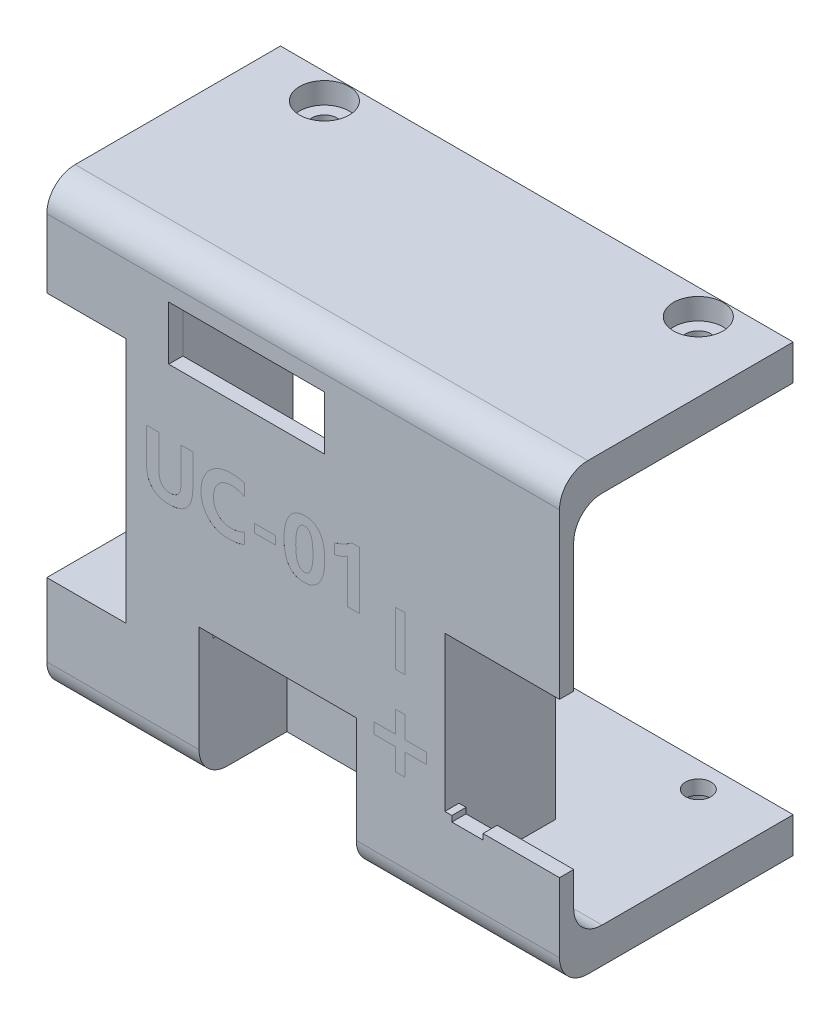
SolidWorks part; units mm, degrees
ref_plane "前视基准面" through (0, 0, 0) normal (0, 0, 1) x (1, 0, 0)
ref_plane "上视基准面" through (0, 0, 0) normal (0, 1, 0) x (1, 0, 0)
ref_plane "右视基准面" through (0, 0, 0) normal (1, 0, 0) x (0, 0, -1)
sketch "草图1" plane through (0, 0, 0) normal (0, 0, 1) x (1, 0, 0)
  line L0 (-17.8, 8.85) -> (-12.8, 8.85)
  line L2 (-12.8, 8.85) -> (-12.8, 0.35)
  line L3 (-12.8, 0.35) -> (-5.9, 0.35)
  line L4 (-5.9, 0.35) -> (-5.9, -6.45)
  line L5 (-5.9, -6.45) -> (-12.8, -6.45)
  line L6 (-12.8, -6.45) -> (-12.8, -8.55)
  line L7 (-12.8, -8.55) -> (-17.8, -8.55)
  line L8 (-17.8, -8.55) -> (-17.8, -14.2)
  line L9 (-17.8, -14.2) -> (17.8, -14.2)
  line L10 (17.8, -14.2) -> (17.8, -8.8)
  line L11 (17.8, -8.8) -> (12.4, -8.8)
  line L12 (9.7, -8.8) -> (9.7, 2.1)
  line L13 (9.7, 2.1) -> (17.8, 2.1)
  line L14 (17.8, 2.1) -> (17.8, 14.2013)
  line L15 (17.8, 14.2013) -> (-17.8, 14.2)
  line L16 (-17.8, 14.2) -> (-17.8, 8.85)
  line L31 (-9.7903, 12.6005) -> (1.2097, 12.6005)
  line L32 (-9.7903, 12.6005) -> (-9.7903, 8.8005)
  line L33 (-9.7903, 8.8005) -> (1.2097, 8.8005)
  line L34 (1.2097, 12.6005) -> (1.2097, 8.8005)
  line L35 (-6.35, -7.9) -> (2.25, -7.9) construction
  line L36 (-6.35, -7.9) -> (-6.35, -11.4) construction
  line L37 (-6.35, -11.4) -> (2.25, -11.4) construction
  line L38 (2.25, -7.9) -> (2.25, -11.4) construction
  line L42 (10.2, -8.8) -> (10.2, -9.2)
  line L43 (10.2, -9.2) -> (12.4, -9.2)
  line L44 (12.4, -9.2) -> (12.4, -8.8)
  line L45 (10.2, -8.8) -> (9.7, -8.8)
  point P0 (1.2097, 10.7005)
  dimension "D1" = 11
  dimension "D3" = 3.8
  dimension "D4" = 3.5
  dimension "D5" = 2.8
  dimension "D20" = 0.4
  dimension "D21" = 5.4
  dimension "D22" = 0.5
extrude "凸台-拉伸1" add sketch "草图1" against normal blind 1
sketch "草图2" plane through (0, 0, -1) normal (0, 0, -1) x (-1, 0, 0)
  line L0 (-17.8, -14.2) -> (-17.8, -8.8) construction
  line L1 (17.8, -14.2) -> (-17.8, -14.2)
  line L2 (17.8, -14.2) -> (17.8, -13.2)
  line L3 (17.8, -13.2) -> (-17.8, -13.2)
  line L4 (-17.8, -14.2) -> (-17.8, -13.2)
  line L6 (17.8, 13.2013) -> (-17.8, 13.2013)
  line L7 (17.8, 13.2013) -> (17.8, 14.2013)
  line L8 (17.8, 14.2013) -> (-17.8, 14.2013)
  line L9 (-17.8, 13.2013) -> (-17.8, 14.2013)
  line L12 (17.8, 14.2) -> (17.8, 8.85) construction
  dimension "D1" = 1
  dimension "D2" = 1
extrude "凸台-拉伸2" add sketch "草图2" along normal blind 15.5
fillet "圆角1" radius 2 2 edges at (0, -13.2, -1) (0, 13.2013, -1)
sketch "草图3" plane through (0, 14.2013, 0) normal (0, 1, 0) x (1, 0, 0)
  line L0 (-17.8, 16.5) -> (17.8, 16.5) construction
  line L3 (-13.5, 14.7) -> (12.9, 14.7) construction
  line L4 (-0.3, 14.7) -> (-0.3, 0) construction
  circle A1 centre (-13.5, 14.7) radius 0.9
  circle A3 centre (12.9, 14.7) radius 0.9
  dimension "D1" = 1.8
  dimension "D2" = 1.8
  dimension "D3" = 26.4
  dimension "D4" = 1.8
  dimension "D5" = 0.3
extrude "切除-拉伸1" cut sketch "草图3" against normal through all
sketch "草图4" plane through (17.8, 0, 0) normal (1, 0, 0) x (0, 0, -1)
  line L0 (2, 14.2013) -> (16.5, 14.2013)
  line L1 (0, 2.1) -> (0, -8.8)
  line L2 (1, 2.1) -> (1, -8.8)
  line L6 (0, -8.8) -> (0, -14.2)
  line L7 (0, -14.2) -> (16.5, -14.2)
  line L8 (16.5, -14.2) -> (16.5, -13.2)
  line L9 (16.5, -13.2) -> (3, -13.2)
  line L10 (1, -11.2) -> (1, -8.8)
  line L11 (1, -8.8) -> (0, -8.8)
  line L12 (0, -8.8) -> (0, -12.2)
  line L13 (2, -14.2) -> (16.5, -14.2)
  line L14 (16.5, -14.2) -> (16.5, -13.2)
  line L15 (16.5, -13.2) -> (3, -13.2)
  line L16 (1, -11.2) -> (1, -8.8)
  line L19 (0, 14.2013) -> (0, 2.1)
  line L20 (0, 2.1) -> (1, 2.1)
  line L21 (1, 2.1) -> (1, 11.2013)
  line L22 (3, 13.2013) -> (16.5, 13.2013)
  line L23 (16.5, 13.2013) -> (16.5, 14.2013)
  line L24 (16.5, 14.2013) -> (1, 14.2013)
  line L26 (0, 12.2013) -> (0, 2.1)
  line L28 (1, 2.1) -> (1, 11.2013)
  line L29 (3, 13.2013) -> (16.5, 13.2013)
  line L30 (16.5, 13.2013) -> (16.5, 14.2013)
  line L36 (1, 14.2013) -> (0, 14.2013)
  arc A0 (0, -12.2) -> (2, -14.2) centre (2, -12.2) ccw
  arc A1 (1, -11.2) -> (3, -13.2) centre (3, -11.2) ccw
  arc A2 (1, -11.2) -> (3, -13.2) centre (3, -11.2) ccw
  arc A3 (3, 13.2013) -> (1, 11.2013) centre (3, 11.2013) ccw
  arc A4 (3, 13.2013) -> (1, 11.2013) centre (3, 11.2013) ccw
  arc A5 (0, 12.2013) -> (2, 14.2013) centre (2, 12.2013) cw
  dimension "D3" = 2
  dimension "D1" = 0
  dimension "D2" = 0
extrude "切除-拉伸2" cut sketch "草图4" against normal through all flip side to cut
other "删除面1"
sketch "草图6" plane through (-17.8, 0, 0) normal (-1, 0, 0) x (0, 0, 1)
  line L0 (-16.5, 13.2013) -> (-3, 13.2013) construction
  line L1 (-16.5, -13.2) -> (-3, -13.2) construction
  line L2 (-1, -8.55) -> (-1, -11.2) construction
  line L3 (-1, 11.2013) -> (-1, 8.85) construction
  line L4 (-10.2, 13.2013) -> (-3, 13.2013)
  line L5 (-10.2, -13.2) -> (-3, -13.2)
  line L6 (-1, -8.55) -> (-1, -11.2)
  line L7 (-1, 11.2013) -> (-1, 8.85)
  line L8 (-1, 8.85) -> (-10.2, 8.85)
  line L9 (-10.2, 12.0027) -> (-10.2, -11.9987) construction
  line L10 (-10.2, 8.85) -> (-10.2, 13.2013)
  line L11 (-1, -8.55) -> (-10.2, -8.55)
  line L12 (-10.2, -8.55) -> (-10.2, -13.2)
  arc A0 (-3, -13.2) -> (-1, -11.2) centre (-3, -11.2) ccw construction
  arc A1 (-1, 11.2013) -> (-3, 13.2013) centre (-3, 11.2013) ccw construction
  arc A2 (-3, -13.2) -> (-1, -11.2) centre (-3, -11.2) ccw
  arc A3 (-1, 11.2013) -> (-3, 13.2013) centre (-3, 11.2013) ccw
extrude "凸台-拉伸3" add sketch "草图6" against normal blind 8
sketch "草图7" plane through (0, 0, -1) normal (0, 0, -1) x (-1, 0, 0)
  line L0 (9.8, 8.85) -> (12.8, 8.85) construction
  line L1 (12.8, 8.85) -> (9.8, 8.85)
  line L2 (12.8, 8.85) -> (12.8, 0.85)
  line L3 (12.8, 0.85) -> (9.8, 0.85)
  line L4 (9.8, 8.85) -> (9.8, 0.85)
  line L5 (12.8, -8.55) -> (9.8, -8.55)
  line L6 (12.8, -8.55) -> (12.8, -6.55)
  line L7 (12.8, -6.55) -> (9.8, -6.55)
  line L8 (9.8, -8.55) -> (9.8, -6.55)
  line L9 (9.8, -11.2) -> (9.8, -8.55) construction
  dimension "D1" = 8
  dimension "D2" = 2
extrude "凸台-拉伸4" add sketch "草图7" along normal blind 7.8
sketch "草图9" plane through (9.7, 0, 0) normal (1, 0, 0) x (0, 0, -1)
  line L1 (1, 11.2013) -> (1, -11.2)
  line L2 (3, -13.2) -> (8.8, -13.2)
  line L4 (8.8, -13.2) -> (8.8, 13.2013)
  line L5 (16.5, 13.2013) -> (3, 13.2013) construction
  line L6 (8.8, 13.2013) -> (3, 13.2013)
  line L7 (16.5, -13.2) -> (3, -13.2) construction
  arc A0 (3, 13.2013) -> (1, 11.2013) centre (3, 11.2013) ccw construction
  arc A1 (1, -11.2) -> (3, -13.2) centre (3, -11.2) ccw construction
  arc A2 (3, 13.2013) -> (1, 11.2013) centre (3, 11.2013) ccw
  arc A3 (1, -11.2) -> (3, -13.2) centre (3, -11.2) ccw
  dimension "D1" = 7.8
extrude "凸台-拉伸6" add sketch "草图9" against normal blind 6 contours L4 L6 A2 L1 A3 L2
other "移动面1" [suppressed] parameters "D1"=5
sketch "草图10" plane through (0, 0, 0) normal (0, 0, 1) x (1, 0, 0)
  line L0 (-12.8, 8.85) -> (-12.8, 10.85)
  line L2 (-12.8, 10.85) -> (-15.3, 10.85)
  line L3 (-15.3, 10.85) -> (-15.3, 8.85)
  line L4 (-17.8, 8.85) -> (-12.8, 8.85) construction
  dimension "D1" = 2.5
  dimension "D2" = 2
extrude "切除-拉伸3" cut sketch "草图10" against normal through all and the other way through all
sketch "草图11" plane through (0, 0, 0) normal (0, 0, 1) x (1, 0, 0)
  line L0 (-15.3, -8.55) -> (-15.3, -10.55)
  line L2 (-15.3, -10.55) -> (-12.8, -10.55)
  line L3 (-12.8, -10.55) -> (-12.8, -8.55)
  line L5 (-12.8, -8.55) -> (-17.8, -8.55) construction
  dimension "D1" = 2.5
  dimension "D2" = 2
extrude "切除-拉伸4" cut sketch "草图11" against normal through all and the other way through all
other "移动面2" parameters "D1"=0.6
other "移动面3" parameters "D1"=4.65
other "移动面5" parameters "D1"=4.35
sketch "草图13" plane through (0, 0, -8.8) normal (0, 0, -1) x (-1, 0, 0)
  line L0 (-3.7, -13.2) -> (-3.7, 13.2013) construction
  line L1 (-9.7, 13.2013) -> (-3.7, 13.2013)
  line L2 (-9.7, 13.2013) -> (-9.7, 0.0007)
  line L3 (-9.7, 0.0007) -> (-3.7, 0.0007)
  line L4 (-3.7, 13.2013) -> (-3.7, 0.0007)
extrude "切除-拉伸5" cut sketch "草图13" against normal blind 1
sketch "草图14" plane through (0, 0, 0) normal (0, 0, 1) x (1, 0, 0)
  line L0 (-12.8, 10.85) -> (-12.8, -10.55) construction
  line L1 (-15.3, 10.85) -> (-12.8, 10.85)
  line L2 (-15.3, 10.85) -> (-15.3, 8.85)
  line L3 (-15.3, 8.85) -> (-12.8, 8.85)
  line L4 (-12.8, 10.85) -> (-12.8, 8.85)
  line L6 (-15.3, -8.55) -> (-12.8, -8.55)
  line L7 (-15.3, -8.55) -> (-15.3, -10.55)
  line L8 (-15.3, -10.55) -> (-12.8, -10.55)
  line L9 (-12.8, -8.55) -> (-12.8, -10.55)
extrude "凸台-拉伸7" add sketch "草图14" against normal up to surface (8.8 mm away)
sketch "草图16" plane through (0, 0, 0) normal (0, 0, 1) x (1, 0, 0)
  line L0 (17.7, -11.9987) -> (-18.3, -11.9987) construction
  line L1 (-7.6499, -8.1987) -> (3.3501, -8.1987)
  line L2 (-7.6499, -8.1987) -> (-7.6499, -11.9987)
  line L3 (-7.6499, -11.9987) -> (3.3501, -11.9987)
  line L4 (3.3501, -8.1987) -> (3.3501, -11.9987)
  line L5 (-7.6499, -8.1987) -> (3.3501, -11.9987) construction
  line L6 (-7.6499, -11.9987) -> (3.3501, -8.1987) construction
  line L7 (-2.1499, -9.7947) -> (-2.1499, -10.3027) construction
  point P4 (-2.1499, -10.0987)
  dimension "D1" = 11
  dimension "D2" = 3.8
extrude "切除-拉伸7" cut sketch "草图16" against normal blind 10
sketch "草图17" plane through (0, -14.2, 0) normal (0, -1, 0) x (1, 0, 0)
  line L1 (-7.6499, 0) -> (3.3501, 0)
  line L2 (-7.6499, 0) -> (-7.6499, -6.2)
  line L3 (-7.6499, -6.2) -> (3.3501, -6.2)
  line L4 (3.3501, 0) -> (3.3501, -6.2)
  line L5 (-7.6499, 0) -> (3.3501, -6.2) construction
  line L6 (-7.6499, -6.2) -> (3.3501, 0) construction
  line L7 (3.3501, -1.1664) -> (3.3501, 0) construction
  line L8 (-18.4, 0) -> (17.8, 0) construction
  point P4 (-2.1499, -3.1)
  dimension "D1" = 6.2
extrude "切除-拉伸8" cut sketch "草图17" against normal up to surface (6.0013 mm away)
sketch "草图18" plane through (0, 0, -1) normal (0, 0, -1) x (-1, 0, 0)
  line L0 (-3.7, 11.2013) -> (-3.7, -11.2) construction
  line L1 (-3.7, -8.1987) -> (5.5675, -8.1987)
  line L2 (-3.7, -8.1987) -> (-3.7, -5.1987)
  line L3 (-3.7, -5.1987) -> (5.5675, -5.1987)
  line L4 (5.5675, -7.3751) -> (5.5675, -5.1987)
  line L5 (-3.7, -8.1987) -> (5.5675, -5.1987) construction
  line L6 (-3.7, -5.1987) -> (5.5675, -8.1987) construction
  line L8 (-3.3501, -8.1987) -> (7.6499, -8.1987) construction
  line L9 (5.5675, -7.3751) -> (9.8, -7.3751)
  line L10 (9.8, -7.3751) -> (9.8, -13.2)
  line L12 (9.8, -13.2) -> (7.6499, -13.2)
  line L13 (7.6499, -13.2) -> (7.6499, -8.1987)
  line L16 (7.6499, -8.1987) -> (5.5675, -8.1987)
  line L17 (9.8, -6.55) -> (9.8, -13.2) construction
  line L19 (9.8, -13.2) -> (7.6499, -13.2) construction
  point P4 (0.9337, -6.6987)
  dimension "D1" = 3
extrude "凸台-拉伸8" add sketch "草图18" along normal up to surface (7.8 mm away)
other "移动面6" parameters "D1"=0.25
sketch "草图20" plane through (0, -14.2, 0) normal (0, -1, 0) x (1, 0, 0)
  line L1 (-7.6499, -6.2) -> (3.7, -6.2)
  line L2 (-7.6499, -6.2) -> (-7.6499, -8.8)
  line L3 (-7.6499, -8.8) -> (3.7, -8.8)
  line L4 (3.7, -6.2) -> (3.7, -8.8)
  line L5 (-7.6499, -6.2) -> (3.7, -8.8) construction
  line L6 (-7.6499, -8.8) -> (3.7, -6.2) construction
  point P4 (-1.9749, -7.5)
extrude "凸台-拉伸9" add sketch "草图20" against normal blind 2.5
other "删除面2"
other "移动面8" parameters "D1"=1.5
sketch "草图21" plane through (0, -15.7, 0) normal (0, -1, 0) x (1, 0, 0)
  circle A0 centre (-13.5, -14.7) radius 1.75
  circle A1 centre (12.9, -14.7) radius 1.75
  dimension "D1" = 3.5
extrude "切除-拉伸9" cut sketch "草图21" against normal blind 1.5
sketch "草图22" plane through (0, 15.7013, 0) normal (0, 1, 0) x (1, 0, 0)
  circle A0 centre (-13.5, 14.7) radius 1.75
  circle A1 centre (12.9, 14.7) radius 1.75
  dimension "D1" = 3.5
extrude "切除-拉伸10" cut sketch "草图22" against normal blind 1.5
fillet "圆角2" radius 2 3 edges at (-13.0249, -15.7, 0) (10.5751, -15.7, 0) (-0.3, 15.7013, 0)
sketch "草图23" plane through (0, 0, 0) normal (0, 0, 1) x (1, 0, 0)
  line L0 (-12.8, 8.85) -> (-12.8, -8.55) construction
  text T0 "UC-01" font "微软雅黑" height 4
  dimension "D1" = 1
extrude "切除-拉伸11" cut sketch "草图23" against normal blind 0.2
sketch "草图24" plane through (0, 0, -0.2) normal (0, 0, 1) x (1, 0, 0)
  line L5 (-2.239, 1.5082) -> (-2.239, 2.0935) construction
  line L6 (-2.239, 2.0935) -> (-3.7512, 2.0935) construction
  line L7 (-3.7512, 2.0935) -> (-3.7512, 1.5082) construction
  line L8 (-3.7512, 1.5082) -> (-2.239, 1.5082) construction
  line L9 (-4.4341, 0.4495) -> (-4.4341, 1.2155) construction
  line L10 (-4.4341, 3.3618) -> (-4.4341, 4.185) construction
  line L11 (-8.0927, 2.0203) -> (-8.0927, 4.2886) construction
  line L12 (-8.0927, 4.2886) -> (-8.922, 4.2886) construction
  line L13 (-8.922, 4.2886) -> (-8.922, 1.9304) construction
  line L14 (-10.4829, 1.967) -> (-10.4829, 4.2886) construction
  line L15 (-10.4829, 4.2886) -> (-11.361, 4.2886) construction
  line L16 (-11.361, 4.2886) -> (-11.361, 1.9739) construction
  line L22 (-2.239, 1.5082) -> (-2.239, 2.0935)
  line L23 (-2.239, 2.0935) -> (-3.7512, 2.0935)
  line L24 (-3.7512, 2.0935) -> (-3.7512, 1.5082)
  line L25 (-3.7512, 1.5082) -> (-2.239, 1.5082)
  line L26 (-4.4341, 0.4495) -> (-4.4341, 1.2155)
  line L27 (-4.4341, 3.3618) -> (-4.4341, 4.185)
  line L28 (-8.0927, 2.0203) -> (-8.0927, 4.2886)
  line L29 (-8.0927, 4.2886) -> (-8.922, 4.2886)
  line L30 (-8.922, 4.2886) -> (-8.922, 1.9304)
  line L31 (-10.4829, 1.967) -> (-10.4829, 4.2886)
  line L32 (-10.4829, 4.2886) -> (-11.361, 4.2886)
  line L33 (-11.361, 4.2886) -> (-11.361, 1.9739)
  line L39 (3.6634, 4.3374) -> (3.1405, 4.3374)
  line L40 (1.9073, 3.733) -> (1.9073, 3.0203)
  line L41 (2.8341, 3.3931) -> (2.8341, 0.2886)
  line L42 (2.8341, 0.2886) -> (3.6634, 0.2886)
  line L43 (3.6634, 0.2886) -> (3.6634, 4.3374)
  line L44 (3.6634, 4.3374) -> (3.1405, 4.3374)
  line L45 (1.9073, 3.733) -> (1.9073, 3.0203)
  line L46 (2.8341, 3.3931) -> (2.8341, 0.2886)
  line L47 (2.8341, 0.2886) -> (3.6634, 0.2886)
  line L48 (3.6634, 0.2886) -> (3.6634, 4.3374)
  spline S3 degree 3 poles (447.3482, -890.9115) (-3.7031, 15.2341) (-1.3723, 2.5269) (-4.6578, 1.1076) (-4.7746, 1.0655) (-4.8945, 1.0311) (-5.0173, 1.0045) (-5.143, 0.9854) (-8.9746, 0.6371) (-13.3163, 12.608) (28.2486, -998.4467) knots -10.258138 -10.258138 -10.258138 -10.258138 0.123289 0.246059 0.368848 0.492193 0.616624 0.741912 0.870046 12.042592 12.042592 12.042592 12.042592 only from (-4.4341, 1.2155) to (-5.4021, 0.9716) construction
  spline S4 degree 3 poles (-58.3829, -997.62) (2.0899, 14.5382) (-2.224, 0.5394) (-5.6685, 0.9915) (-5.7921, 1.0193) (-5.9084, 1.0588) (-6.0178, 1.1077) (-6.1193, 1.1696) (-6.2134, 1.2425) (-6.3001, 1.3254) (-6.3779, 1.4176) (-6.4452, 1.5179) (-6.502, 1.6255) (-6.5482, 1.74) (-6.5853, 1.8613) (-6.6108, 1.9897) (-7.0383, 5.7463) (6.2612, 10.2353) (-1005.5774, -43.2789) knots -4.971116 -4.971116 -4.971116 -4.971116 0.068212 0.133499 0.196423 0.256776 0.316257 0.374705 0.433557 0.493283 0.55321 0.612969 0.672933 0.734251 0.796781 0.861688 0.929139 6.423769 6.423769 6.423769 6.423769 only from (-5.4021, 0.9716) to (-6.6293, 2.2658) construction
  spline S5 degree 3 poles (-1005.0194, 58.9049) (7.2315, -5.5986) (-7.0712, -1.0508) (-6.6088, 2.5493) (-6.5834, 2.6819) (-6.5435, 2.8065) (-6.4952, 2.925) (-6.4344, 3.0358) (-6.3634, 3.14) (-6.2818, 3.2359) (-6.1914, 3.3228) (-6.0925, 3.3987) (-5.9863, 3.4631) (-5.8724, 3.5148) (-5.7519, 3.5567) (-5.6235, 3.5852) (-1.9471, 4.0411) (2.5575, -9.464) (-57.0147, 1002.2588) knots -5.005182 -5.005182 -5.005182 -5.005182 0.070115 0.137017 0.20143 0.263758 0.324619 0.384879 0.445005 0.50533 0.565469 0.624812 0.684081 0.74352 0.80411 0.866968 0.932059 6.116477 6.116477 6.116477 6.116477 only from (-6.6293, 2.2658) to (-5.348, 3.6057) construction
  spline S6 degree 3 poles (31.8274, 1002.913) (-12.9494, -8.1188) (-8.7481, 3.9419) (-5.1001, 3.5918) (-4.9804, 3.5729) (-4.8642, 3.5463) (-4.7515, 3.5116) (-4.6419, 3.4698) (-1.6184, 2.0699) (-4.6337, -10.5677) (474.6811, 881.1006) knots -11.08115 -11.08115 -11.08115 -11.08115 0.131365 0.260042 0.386555 0.51068 0.633019 0.755687 0.877798 11.054687 11.054687 11.054687 11.054687 only from (-5.348, 3.6057) to (-4.4341, 3.3618) construction
  spline S7 degree 3 poles (327.0674, 947.639) (-1.7117, -8.2725) (-1.351, 3.2979) (-4.6427, 4.2535) (-4.7555, 4.2791) (-4.8743, 4.3006) (-4.9989, 4.317) (-5.1293, 4.3294) (-10.0457, 4.5726) (-15.1405, -5.5057) (1.7412, 1004.308) knots -10.047872 -10.047872 -10.047872 -10.047872 0.107963 0.220366 0.337373 0.458737 0.586233 0.718567 0.855895 15.509195 15.509195 15.509195 15.509195 only from (-4.4341, 4.185) to (-5.4059, 4.3374) construction
  spline S8 degree 3 poles (-57.6899, 1002.9688) (4.8826, -11.7097) (-1.0209, 4.9509) (-5.8467, 4.3035) (-6.0532, 4.2577) (-6.2486, 4.1914) (-6.4341, 4.1079) (-6.608, 4.0037) (-6.7721, 3.8824) (-6.9228, 3.7421) (-7.0597, 3.5879) (-7.1799, 3.4223) (-7.2815, 3.2455) (-7.3636, 3.0577) (-7.4291, 2.8596) (-7.4742, 2.6503) (-8.1108, -2.3067) (8.3132, -8.2822) (-1006.272, 51.6656) knots -4.141639 -4.141639 -4.141639 -4.141639 0.067389 0.13232 0.194855 0.255866 0.316133 0.376011 0.436454 0.4979 0.55941 0.620133 0.680255 0.740957 0.802757 0.866128 0.931705 5.254621 5.254621 5.254621 5.254621 only from (-5.4059, 4.3374) to (-7.5073, 2.204) construction
  spline S9 degree 3 poles (-1006.6116, -40.0715) (7.5102, 12.5009) (-8.0628, 6.7177) (-7.478, 1.7826) (-7.4368, 1.5864) (-7.3799, 1.4011) (-7.3058, 1.227) (-7.2143, 1.0645) (-7.1073, 0.9129) (-6.9845, 0.7733) (-6.8475, 0.6478) (-6.6982, 0.5376) (-6.5361, 0.4464) (-6.3636, 0.3701) (-6.1792, 0.3118) (-5.9834, 0.2699) (-1.1365, -0.3279) (4.6206, 15.6065) (-50.5508, -998.7248) knots -4.566138 -4.566138 -4.566138 -4.566138 0.069616 0.136223 0.200084 0.261924 0.322179 0.381519 0.440709 0.500203 0.559804 0.618828 0.678076 0.738077 0.799831 0.863504 0.93014 5.483125 5.483125 5.483125 5.483125 only from (-7.5073, 2.204) to (-5.5614, 0.2399) construction
  spline S10 degree 3 poles (8.5748, -999.6594) (-15.6172, 11.7428) (-10.2761, -0.0632) (-5.2329, 0.2514) (-5.0795, 0.2681) (-4.9342, 0.2908) (-4.7968, 0.3193) (-4.6682, 0.3563) (-1.3965, 1.4907) (-3.0171, 14.5127) (382.1615, -921.7816) knots -12.687678 -12.687678 -12.687678 -12.687678 0.147062 0.286452 0.419776 0.547259 0.667915 0.783756 0.894285 9.644628 9.644628 9.644628 9.644628 only from (-5.5614, 0.2399) to (-4.4341, 0.4495) construction
  spline S11 degree 3 poles (990.6881, -25.9645) (-19.9383, 9.2654) (-8.6331, 5.2812) (-8.9327, 1.7077) (-8.948, 1.6064) (-8.9681, 1.5124) (-8.9957, 1.426) (-9.029, 1.3468) (-9.0678, 1.2747) (-9.1142, 1.2114) (-9.1652, 1.154) (-9.2236, 1.1054) (-9.2874, 1.0636) (-9.3578, 1.03) (-9.4338, 1.0031) (-9.5163, 0.9855) (-12.1393, 0.629) (-15.6353, 13.0838) (52.8097, -997.0511) knots -7.393918 -7.393918 -7.393918 -7.393918 0.082236 0.159849 0.232589 0.300169 0.36431 0.425385 0.48275 0.53814 0.59213 0.645867 0.699421 0.754089 0.81139 0.870698 0.933422 6.436963 6.436963 6.436963 6.436963 only from (-8.922, 1.9304) to (-9.6963, 0.9716) construction
  spline S12 degree 3 poles (-60.1304, -997.7553) (-3.708, 12.7839) (-7.145, 0.6379) (-9.8796, 0.985) (-9.9629, 1.0047) (-10.0401, 1.0324) (-10.1113, 1.0675) (-10.1766, 1.1102) (-10.2353, 1.1615) (-10.2878, 1.2201) (-10.334, 1.2868) (-10.3745, 1.3608) (-10.408, 1.4432) (-10.4348, 1.5332) (-10.4575, 1.6306) (-10.472, 1.7359) (-10.7759, 5.396) (0.7037, 9.5294) (-1009.9473, -30.5076) knots -5.506458 -5.506458 -5.506458 -5.506458 0.065783 0.127811 0.186736 0.242624 0.297183 0.350708 0.403639 0.458007 0.513148 0.571273 0.63211 0.696983 0.765484 0.838809 0.91689 8.36214 8.36214 8.36214 8.36214 only from (-9.6963, 0.9716) to (-10.4829, 1.967) construction
  spline S13 degree 3 poles (-1010.7633, -32.5066) (2.9776, 12.2638) (-11.8358, 6.5734) (-11.3384, 1.5713) (-11.308, 1.3876) (-11.2636, 1.2175) (-11.2077, 1.0608) (-11.1387, 0.9175) (-11.0571, 0.7877) (-10.9617, 0.6719) (-10.8547, 0.5689) (-10.7342, 0.4806) (-10.6017, 0.4057) (-10.4564, 0.3445) (-10.2986, 0.2975) (-10.1283, 0.2645) (-5.5741, -0.2614) (-0.1904, 14.8104) (-53.3661, -998.8082) knots -5.339301 -5.339301 -5.339301 -5.339301 0.077366 0.150259 0.218727 0.283252 0.344541 0.402648 0.458898 0.513844 0.568341 0.622841 0.678755 0.736469 0.796966 0.860609 0.928246 5.863965 5.863965 5.863965 5.863965 only from (-11.361, 1.9739) to (-9.755, 0.2399) construction
  spline S14 degree 3 poles (36.0873, -998.707) (-19.4521, 15.2136) (-13.9656, -0.2759) (-9.3688, 0.2654) (-9.1925, 0.2986) (-9.0294, 0.3477) (-8.8786, 0.4099) (-8.7416, 0.4875) (-8.6166, 0.5778) (-8.5056, 0.6832) (-8.4069, 0.8021) (-8.3235, 0.936) (-8.2512, 1.0826) (-8.1926, 1.2434) (-8.1483, 1.4185) (-8.1155, 1.6067) (-7.6201, 6.9397) (-21.8649, 12.842) (991.5286, -25.4517) knots -4.759628 -4.759628 -4.759628 -4.759628 0.072067 0.139886 0.203826 0.264504 0.322468 0.378541 0.43322 0.487644 0.542487 0.598649 0.656728 0.71775 0.782003 0.850404 0.922752 6.526676 6.526676 6.526676 6.526676 only from (-9.755, 0.2399) to (-8.0927, 2.0203) construction
  spline S17 degree 3 poles (1177.1826, -1614.7304) (2.6721, 26.1054) (8.1484, 7.6131) (2.8687, 4.1488) (2.7228, 4.0656) (2.5716, 3.9868) (2.4147, 3.9133) (2.251, 3.8475) (-3.9719, 1.5791) (-16.3139, 18.0778) (609.1367, -1901.742) knots -13.347297 -13.347297 -13.347297 -13.347297 0.11901 0.23902 0.360663 0.483838 0.609267 0.736759 0.866991 14.991437 14.991437 14.991437 14.991437 only from (3.1405, 4.3374) to (1.9073, 3.733)
  spline S18 degree 3 poles (-4.4341, 1.2155) (-4.4707, 1.1959) (-4.5437, 1.1568) (-4.6578, 1.1076) (-4.7746, 1.0655) (-4.8945, 1.0311) (-5.0173, 1.0045) (-5.143, 0.9854) (-5.2716, 0.9737) (-5.3584, 0.9723) (-5.4021, 0.9716) knots 0 0 0 0 0.123289 0.246059 0.368848 0.492193 0.616624 0.741912 0.870046 1 1 1 1
  spline S19 degree 3 poles (-5.4021, 0.9716) (-5.4479, 0.9725) (-5.5375, 0.9743) (-5.6685, 0.9915) (-5.7921, 1.0193) (-5.9084, 1.0588) (-6.0178, 1.1077) (-6.1193, 1.1696) (-6.2134, 1.2425) (-6.3001, 1.3254) (-6.3779, 1.4176) (-6.4452, 1.5179) (-6.502, 1.6255) (-6.5482, 1.74) (-6.5853, 1.8613) (-6.6108, 1.9897) (-6.6262, 2.1254) (-6.6282, 2.2182) (-6.6293, 2.2658) knots 0 0 0 0 0.068212 0.133499 0.196423 0.256776 0.316257 0.374705 0.433557 0.493283 0.55321 0.612969 0.672933 0.734251 0.796781 0.861688 0.929139 1 1 1 1
  spline S20 degree 3 poles (-6.6293, 2.2658) (-6.6284, 2.3146) (-6.6267, 2.4101) (-6.6088, 2.5493) (-6.5834, 2.6819) (-6.5435, 2.8065) (-6.4952, 2.925) (-6.4344, 3.0358) (-6.3634, 3.14) (-6.2818, 3.2359) (-6.1914, 3.3228) (-6.0925, 3.3987) (-5.9863, 3.4631) (-5.8724, 3.5148) (-5.7519, 3.5567) (-5.6235, 3.5852) (-5.4879, 3.602) (-5.3953, 3.6045) (-5.348, 3.6057) knots 0 0 0 0 0.070115 0.137017 0.20143 0.263758 0.324619 0.384879 0.445005 0.50533 0.565469 0.624812 0.684081 0.74352 0.80411 0.866968 0.932059 1 1 1 1
  spline S21 degree 3 poles (-5.348, 3.6057) (-5.3061, 3.605) (-5.223, 3.6036) (-5.1001, 3.5918) (-4.9804, 3.5729) (-4.8642, 3.5463) (-4.7515, 3.5116) (-4.6419, 3.4698) (-4.5354, 3.4205) (-4.4679, 3.3814) (-4.4341, 3.3618) knots 0 0 0 0 0.131365 0.260042 0.386555 0.51068 0.633019 0.755687 0.877798 1 1 1 1
  spline S22 degree 3 poles (-4.4341, 4.185) (-4.4675, 4.1973) (-4.5357, 4.2225) (-4.6427, 4.2535) (-4.7555, 4.2791) (-4.8743, 4.3006) (-4.9989, 4.317) (-5.1293, 4.3294) (-5.2656, 4.3361) (-5.3584, 4.337) (-5.4059, 4.3374) knots 0 0 0 0 0.107963 0.220366 0.337373 0.458737 0.586233 0.718567 0.855895 1 1 1 1
  spline S23 degree 3 poles (-5.4059, 4.3374) (-5.4815, 4.3358) (-5.6298, 4.3326) (-5.8467, 4.3035) (-6.0532, 4.2577) (-6.2486, 4.1914) (-6.4341, 4.1079) (-6.608, 4.0037) (-6.7721, 3.8824) (-6.9228, 3.7421) (-7.0597, 3.5879) (-7.1799, 3.4223) (-7.2815, 3.2455) (-7.3636, 3.0577) (-7.4291, 2.8596) (-7.4742, 2.6503) (-7.5024, 2.4307) (-7.5056, 2.2806) (-7.5073, 2.204) knots 0 0 0 0 0.067389 0.13232 0.194855 0.255866 0.316133 0.376011 0.436454 0.4979 0.55941 0.620133 0.680255 0.740957 0.802757 0.866128 0.931705 1 1 1 1
  spline S24 degree 3 poles (-7.5073, 2.204) (-7.5057, 2.1316) (-7.5025, 1.9897) (-7.478, 1.7826) (-7.4368, 1.5864) (-7.3799, 1.4011) (-7.3058, 1.227) (-7.2143, 1.0645) (-7.1073, 0.9129) (-6.9845, 0.7733) (-6.8475, 0.6478) (-6.6982, 0.5376) (-6.5361, 0.4464) (-6.3636, 0.3701) (-6.1792, 0.3118) (-5.9834, 0.2699) (-5.7763, 0.2444) (-5.6342, 0.2414) (-5.5614, 0.2399) knots 0 0 0 0 0.069616 0.136223 0.200084 0.261924 0.322179 0.381519 0.440709 0.500203 0.559804 0.618828 0.678076 0.738077 0.799831 0.863504 0.93014 1 1 1 1
  spline S25 degree 3 poles (-5.5614, 0.2399) (-5.5048, 0.2404) (-5.3944, 0.2413) (-5.2329, 0.2514) (-5.0795, 0.2681) (-4.9342, 0.2908) (-4.7968, 0.3193) (-4.6682, 0.3563) (-4.5472, 0.3982) (-4.4713, 0.4326) (-4.4341, 0.4495) knots 0 0 0 0 0.147062 0.286452 0.419776 0.547259 0.667915 0.783756 0.894285 1 1 1 1
  spline S26 degree 3 poles (-8.922, 1.9304) (-8.9225, 1.8918) (-8.9236, 1.8167) (-8.9327, 1.7077) (-8.948, 1.6064) (-8.9681, 1.5124) (-8.9957, 1.426) (-9.029, 1.3468) (-9.0678, 1.2747) (-9.1142, 1.2114) (-9.1652, 1.154) (-9.2236, 1.1054) (-9.2874, 1.0636) (-9.3578, 1.03) (-9.4338, 1.0031) (-9.5163, 0.9855) (-9.6043, 0.9735) (-9.665, 0.9722) (-9.6963, 0.9716) knots 0 0 0 0 0.082236 0.159849 0.232589 0.300169 0.36431 0.425385 0.48275 0.53814 0.59213 0.645867 0.699421 0.754089 0.81139 0.870698 0.933422 1 1 1 1
  spline S27 degree 3 poles (-9.6963, 0.9716) (-9.7281, 0.9723) (-9.7899, 0.9736) (-9.8796, 0.985) (-9.9629, 1.0047) (-10.0401, 1.0324) (-10.1113, 1.0675) (-10.1766, 1.1102) (-10.2353, 1.1615) (-10.2878, 1.2201) (-10.334, 1.2868) (-10.3745, 1.3608) (-10.408, 1.4432) (-10.4348, 1.5332) (-10.4575, 1.6306) (-10.472, 1.7359) (-10.4813, 1.8489) (-10.4824, 1.9268) (-10.4829, 1.967) knots 0 0 0 0 0.065783 0.127811 0.186736 0.242624 0.297183 0.350708 0.403639 0.458007 0.513148 0.571273 0.63211 0.696983 0.765484 0.838809 0.91689 1 1 1 1
  spline S28 degree 3 poles (-11.361, 1.9739) (-11.36, 1.9039) (-11.358, 1.7681) (-11.3384, 1.5713) (-11.308, 1.3876) (-11.2636, 1.2175) (-11.2077, 1.0608) (-11.1387, 0.9175) (-11.0571, 0.7877) (-10.9617, 0.6719) (-10.8547, 0.5689) (-10.7342, 0.4806) (-10.6017, 0.4057) (-10.4564, 0.3445) (-10.2986, 0.2975) (-10.1283, 0.2645) (-9.9459, 0.2434) (-9.8199, 0.2411) (-9.755, 0.2399) knots 0 0 0 0 0.077366 0.150259 0.218727 0.283252 0.344541 0.402648 0.458898 0.513844 0.568341 0.622841 0.678755 0.736469 0.796966 0.860609 0.928246 1 1 1 1
  spline S29 degree 3 poles (-9.755, 0.2399) (-9.6879, 0.241) (-9.5576, 0.2432) (-9.3688, 0.2654) (-9.1925, 0.2986) (-9.0294, 0.3477) (-8.8786, 0.4099) (-8.7416, 0.4875) (-8.6166, 0.5778) (-8.5056, 0.6832) (-8.4069, 0.8021) (-8.3235, 0.936) (-8.2512, 1.0826) (-8.1926, 1.2434) (-8.1483, 1.4185) (-8.1155, 1.6067) (-8.0967, 1.8091) (-8.0941, 1.9484) (-8.0927, 2.0203) knots 0 0 0 0 0.072067 0.139886 0.203826 0.264504 0.322468 0.378541 0.43322 0.487644 0.542487 0.598649 0.656728 0.71775 0.782003 0.850404 0.922752 1 1 1 1
  spline S30 degree 3 poles (345.0808, -1967.2626) (-9.5696, 20.842) (-1.9523, 2.0887) (2.1487, 3.0663) (2.2762, 3.1046) (2.4059, 3.1518) (2.5319, 3.2047) (2.6463, 3.2635) (5.7336, 5.1244) (-3.6058, 24.4526) (1167.4311, -1622.4991) knots -12.13168 -12.13168 -12.13168 -12.13168 0.116848 0.240752 0.372278 0.511899 0.650498 0.777711 0.893917 11.331892 11.331892 11.331892 11.331892 only from (1.9073, 3.0203) to (2.8341, 3.3931)
  spline S31 degree 3 poles (-2000.7953, -52.1675) (20.3133, 17.4544) (-2.2049, 9.205) (-1.6338, 1.7642) (-1.6073, 1.5543) (-1.5683, 1.36) (-1.5194, 1.1808) (-1.4585, 1.0172) (-1.3869, 0.8688) (-1.3036, 0.7358) (-1.2088, 0.6187) (-1.1034, 0.5164) (-0.986, 0.4306) (-0.8575, 0.3609) (-0.7182, 0.3064) (-0.5679, 0.268) (4.1878, -0.4515) (10.7859, 24.6644) (-132.5936, -1995.2913) knots -7.822298 -7.822298 -7.822298 -7.822298 0.086578 0.167865 0.244075 0.315263 0.381998 0.444776 0.503765 0.559952 0.614067 0.666344 0.718446 0.770706 0.824131 0.879782 0.938113 6.012932 6.012932 6.012932 6.012932 only from (-1.6537, 2.2246) to (-0.2383, 0.2399)
  spline S32 degree 3 poles (131.3302, -1995.3425) (-11.311, 24.5676) (-4.6938, -0.4727) (0.0946, 0.2697) (0.2471, 0.3126) (0.389, 0.3726) (0.5215, 0.4479) (0.6423, 0.5425) (0.7522, 0.6537) (0.8517, 0.7812) (0.9398, 0.9239) (1.0161, 1.0814) (1.0808, 1.2529) (1.1339, 1.4385) (1.1749, 1.6383) (1.2031, 1.852) (1.7947, 9.3898) (-20.544, 17.7602) (2000.3662, -54.5295) knots -4.876629 -4.876629 -4.876629 -4.876629 0.060073 0.117299 0.171929 0.225233 0.277923 0.330711 0.384967 0.440945 0.49937 0.559927 0.623536 0.690675 0.761437 0.836458 0.915811 8.657474 8.657474 8.657474 8.657474 only from (-0.2383, 0.2399) to (1.2244, 2.3168)
  spline S33 degree 3 poles (2000.6666, 45.3728) (-19.918, -13.603) (1.7529, -5.0777) (1.2056, 2.7857) (1.1786, 2.9993) (1.1404, 3.197) (1.0935, 3.3796) (1.0327, 3.5455) (0.9632, 3.6966) (0.882, 3.8321) (0.7898, 3.9518) (0.6857, 4.055) (0.5715, 4.1428) (0.4457, 4.2142) (0.3094, 4.2699) (0.1622, 4.3095) (-4.5314, 5.0226) (-11.0019, -19.8525) (128.6121, 2000.1168) knots -8.247954 -8.247954 -8.247954 -8.247954 0.087973 0.170373 0.247723 0.319998 0.387454 0.450729 0.510302 0.566596 0.620689 0.672807 0.72421 0.775629 0.828343 0.88258 0.939659 5.933718 5.933718 5.933718 5.933718 only from (1.2244, 2.3168) to (-0.1605, 4.3374)
  spline S34 degree 3 poles (-129.3875, 2000.0838) (11.0603, -20.0947) (4.3758, 5.052) (-0.5004, 4.3075) (-0.6563, 4.2648) (-0.8016, 4.2051) (-0.9361, 4.1282) (-1.06, 4.0344) (-1.1725, 3.9228) (-1.2741, 3.7948) (-1.3639, 3.6509) (-1.4418, 3.4917) (-1.5081, 3.3177) (-1.561, 3.128) (-1.6024, 2.9237) (-1.633, 2.7041) (-2.2112, -5.2487) (19.609, -13.8563) (-2001.1154, 44.0574) knots -4.866609 -4.866609 -4.866609 -4.866609 0.060191 0.117319 0.172128 0.225344 0.277803 0.330379 0.38412 0.439685 0.497456 0.557518 0.621033 0.687852 0.759059 0.834479 0.914866 8.921272 8.921272 8.921272 8.921272 only from (-0.1605, 4.3374) to (-1.6537, 2.2246)
  spline S35 degree 3 poles (-1.6537, 2.2246) (-1.6528, 2.1445) (-1.6511, 1.9893) (-1.6338, 1.7642) (-1.6073, 1.5543) (-1.5683, 1.36) (-1.5194, 1.1808) (-1.4585, 1.0172) (-1.3869, 0.8688) (-1.3036, 0.7358) (-1.2088, 0.6187) (-1.1034, 0.5164) (-0.986, 0.4306) (-0.8575, 0.3609) (-0.7182, 0.3064) (-0.5679, 0.268) (-0.4067, 0.2437) (-0.2955, 0.2411) (-0.2383, 0.2399) knots 0 0 0 0 0.086578 0.167865 0.244075 0.315263 0.381998 0.444776 0.503765 0.559952 0.614067 0.666344 0.718446 0.770706 0.824131 0.879782 0.938113 1 1 1 1
  spline S36 degree 3 poles (-0.2383, 0.2399) (-0.1808, 0.2414) (-0.0685, 0.2444) (0.0946, 0.2697) (0.2471, 0.3126) (0.389, 0.3726) (0.5215, 0.4479) (0.6423, 0.5425) (0.7522, 0.6537) (0.8517, 0.7812) (0.9398, 0.9239) (1.0161, 1.0814) (1.0808, 1.2529) (1.1339, 1.4385) (1.1749, 1.6383) (1.2031, 1.852) (1.221, 2.0797) (1.2232, 2.2363) (1.2244, 2.3168) knots 0 0 0 0 0.060073 0.117299 0.171929 0.225233 0.277923 0.330711 0.384967 0.440945 0.49937 0.559927 0.623536 0.690675 0.761437 0.836458 0.915811 1 1 1 1
  spline S37 degree 3 poles (1.2244, 2.3168) (1.2234, 2.3984) (1.2215, 2.5564) (1.2056, 2.7857) (1.1786, 2.9993) (1.1404, 3.197) (1.0935, 3.3796) (1.0327, 3.5455) (0.9632, 3.6966) (0.882, 3.8321) (0.7898, 3.9518) (0.6857, 4.055) (0.5715, 4.1428) (0.4457, 4.2142) (0.3094, 4.2699) (0.1622, 4.3095) (0.0044, 4.3335) (-0.1045, 4.3361) (-0.1605, 4.3374) knots 0 0 0 0 0.087973 0.170373 0.247723 0.319998 0.387454 0.450729 0.510302 0.566596 0.620689 0.672807 0.72421 0.775629 0.828343 0.88258 0.939659 1 1 1 1
  spline S38 degree 3 poles (-0.1605, 4.3374) (-0.2193, 4.3359) (-0.3339, 4.3329) (-0.5004, 4.3075) (-0.6563, 4.2648) (-0.8016, 4.2051) (-0.9361, 4.1282) (-1.06, 4.0344) (-1.1725, 3.9228) (-1.2741, 3.7948) (-1.3639, 3.6509) (-1.4418, 3.4917) (-1.5081, 3.3177) (-1.561, 3.128) (-1.6024, 2.9237) (-1.633, 2.7041) (-1.6501, 2.4693) (-1.6525, 2.3077) (-1.6537, 2.2246) knots 0 0 0 0 0.060191 0.117319 0.172128 0.225344 0.277803 0.330379 0.38412 0.439685 0.497456 0.557518 0.621033 0.687852 0.759059 0.834479 0.914866 1 1 1 1
  spline S39 degree 3 poles (2000.2434, 23.277) (-15.6656, -12.1454) (0.6979, -4.6142) (0.387, 2.615) (0.3759, 2.7645) (0.3599, 2.9028) (0.3399, 3.0305) (0.3138, 3.1469) (0.2846, 3.2525) (0.2503, 3.3468) (0.2117, 3.4307) (0.1679, 3.5032) (0.119, 3.5645) (0.0665, 3.6159) (0.008, 3.6551) (-0.0552, 3.6831) (-2.2508, 4.2483) (-7.175, -17.6966) (235.9332, 1989.5484) knots -12.611783 -12.611783 -12.611783 -12.611783 0.10193 0.197596 0.286641 0.369181 0.445811 0.516808 0.581768 0.641097 0.695609 0.746029 0.7918 0.835052 0.876512 0.916664 0.957753 4.88891 4.88891 4.88891 4.88891 only from (0.3951, 2.2864) to (-0.1933, 3.7033)
  spline S40 degree 3 poles (-243.0952, 1988.8684) (7.1287, -18.4733) (1.9384, 4.2687) (-0.3412, 3.6822) (-0.4091, 3.6541) (-0.471, 3.6126) (-0.5289, 3.5611) (-0.5809, 3.4976) (-0.6273, 3.4228) (-0.6691, 3.3369) (-0.7063, 3.2397) (-0.7381, 3.1311) (-0.7644, 3.0111) (-0.7862, 2.8798) (-0.8038, 2.7371) (-0.8154, 2.5833) (-1.153, -4.3505) (16.4997, -11.6721) (-2000.5366, 30.7432) knots -3.886049 -3.886049 -3.886049 -3.886049 0.043706 0.085899 0.127119 0.169323 0.21317 0.259615 0.309575 0.363977 0.423327 0.487889 0.558021 0.634071 0.716217 0.804564 0.89884 12.626563 12.626563 12.626563 12.626563 only from (-0.1933, 3.7033) to (-0.8244, 2.2452)
  spline S41 degree 3 poles (-2000.4391, -32.678) (16.6502, 15.289) (-1.1572, 8.3878) (-0.8153, 1.9272) (-0.8045, 1.7825) (-0.788, 1.6484) (-0.7657, 1.5251) (-0.7402, 1.4122) (-0.7096, 1.31) (-0.6723, 1.2189) (-0.6329, 1.1374) (-0.5867, 1.0674) (-0.5361, 1.0077) (-0.4804, 0.9583) (-0.4193, 0.9204) (-0.3536, 0.8935) (1.9923, 0.3402) (6.8365, 22.0536) (-218.3495, -1987.1392) knots -11.419951 -11.419951 -11.419951 -11.419951 0.100208 0.194085 0.281228 0.362752 0.438396 0.507745 0.572154 0.631131 0.685603 0.735702 0.782315 0.826937 0.869665 0.911916 0.954842 5.20304 5.20304 5.20304 5.20304 only from (-0.8244, 2.2452) to (-0.2093, 0.874)
  spline S42 degree 3 poles (232.1001, -1985.5075) (-7.2773, 22.4412) (-2.3191, 0.3267) (-0.0674, 0.8942) (-0.0027, 0.9221) (0.057, 0.9614) (0.1119, 1.0119) (0.1613, 1.0737) (0.2063, 1.1459) (0.2468, 1.2288) (0.2815, 1.3232) (0.3114, 1.4286) (0.3386, 1.5444) (0.3582, 1.6717) (0.3752, 1.8097) (0.3872, 1.9589) (0.6924, 9.2788) (-15.3838, 16.8632) (2000.22, -14.6172) knots -3.970386 -3.970386 -3.970386 -3.970386 0.043445 0.085263 0.126098 0.168161 0.211609 0.258133 0.308226 0.362525 0.421797 0.486648 0.55705 0.632959 0.715256 0.804016 0.898887 13.727447 13.727447 13.727447 13.727447 only from (-0.2093, 0.874) to (0.3951, 2.2864)
  spline S43 degree 3 poles (0.3951, 2.2864) (0.3947, 2.3435) (0.3939, 2.4544) (0.387, 2.615) (0.3759, 2.7645) (0.3599, 2.9028) (0.3399, 3.0305) (0.3138, 3.1469) (0.2846, 3.2525) (0.2503, 3.3468) (0.2117, 3.4307) (0.1679, 3.5032) (0.119, 3.5645) (0.0665, 3.6159) (0.008, 3.6551) (-0.0552, 3.6831) (-0.1227, 3.7005) (-0.1696, 3.7023) (-0.1933, 3.7033) knots 0 0 0 0 0.10193 0.197596 0.286641 0.369181 0.445811 0.516808 0.581768 0.641097 0.695609 0.746029 0.7918 0.835052 0.876512 0.916664 0.957753 1 1 1 1
  spline S44 degree 3 poles (-0.1933, 3.7033) (-0.2188, 3.7024) (-0.269, 3.7008) (-0.3412, 3.6822) (-0.4091, 3.6541) (-0.471, 3.6126) (-0.5289, 3.5611) (-0.5809, 3.4976) (-0.6273, 3.4228) (-0.6691, 3.3369) (-0.7063, 3.2397) (-0.7381, 3.1311) (-0.7644, 3.0111) (-0.7862, 2.8798) (-0.8038, 2.7371) (-0.8154, 2.5833) (-0.8234, 2.418) (-0.8241, 2.3041) (-0.8244, 2.2452) knots 0 0 0 0 0.043706 0.085899 0.127119 0.169323 0.21317 0.259615 0.309575 0.363977 0.423327 0.487889 0.558021 0.634071 0.716217 0.804564 0.89884 1 1 1 1
  spline S45 degree 3 poles (-0.8244, 2.2452) (-0.8241, 2.1898) (-0.8235, 2.0825) (-0.8153, 1.9272) (-0.8045, 1.7825) (-0.788, 1.6484) (-0.7657, 1.5251) (-0.7402, 1.4122) (-0.7096, 1.31) (-0.6723, 1.2189) (-0.6329, 1.1374) (-0.5867, 1.0674) (-0.5361, 1.0077) (-0.4804, 0.9583) (-0.4193, 0.9204) (-0.3536, 0.8935) (-0.283, 0.8768) (-0.2343, 0.875) (-0.2093, 0.874) knots 0 0 0 0 0.100208 0.194085 0.281228 0.362752 0.438396 0.507745 0.572154 0.631131 0.685603 0.735702 0.782315 0.826937 0.869665 0.911916 0.954842 1 1 1 1
  spline S46 degree 3 poles (-0.2093, 0.874) (-0.1848, 0.8749) (-0.1367, 0.8767) (-0.0674, 0.8942) (-0.0027, 0.9221) (0.057, 0.9614) (0.1119, 1.0119) (0.1613, 1.0737) (0.2063, 1.1459) (0.2468, 1.2288) (0.2815, 1.3232) (0.3114, 1.4286) (0.3386, 1.5444) (0.3582, 1.6717) (0.3752, 1.8097) (0.3872, 1.9589) (0.3939, 2.1191) (0.3947, 2.2294) (0.3951, 2.2864) knots 0 0 0 0 0.043445 0.085263 0.126098 0.168161 0.211609 0.258133 0.308226 0.362525 0.421797 0.486648 0.55705 0.632959 0.715256 0.804016 0.898887 1 1 1 1
  spline S47 degree 3 poles (3.1405, 4.3374) (3.0964, 4.305) (3.0076, 4.24) (2.8687, 4.1488) (2.7228, 4.0656) (2.5716, 3.9868) (2.4147, 3.9133) (2.251, 3.8475) (2.0819, 3.7859) (1.9659, 3.7507) (1.9073, 3.733) knots 0 0 0 0 0.11901 0.23902 0.360663 0.483838 0.609267 0.736759 0.866991 1 1 1 1
  spline S48 degree 3 poles (1.9073, 3.0203) (1.9463, 3.0259) (2.0266, 3.0372) (2.1487, 3.0663) (2.2762, 3.1046) (2.4059, 3.1518) (2.5319, 3.2047) (2.6463, 3.2635) (2.7474, 3.3244) (2.8061, 3.3709) (2.8341, 3.3931) knots 0 0 0 0 0.116848 0.240752 0.372278 0.511899 0.650498 0.777711 0.893917 1 1 1 1
  dimension "D1" = 0
  dimension "D2" = 0
  dimension "D3" = 0
extrude "凸台-拉伸10" add sketch "草图24" along normal blind 0.2 separate body
sketch "草图25" plane through (0, 0, 0) normal (0, 0, 1) x (1, 0, 0)
  line L0 (3.5681, 2.1) -> (3.5681, -8.8) construction
  text T0 "-+" font "@黑体" height 5.5
extrude "切除-拉伸12" cut sketch "草图25" against normal blind 0.2
sketch "草图26" plane through (0, 0, -8.8) normal (0, 0, -1) x (-1, 0, 0)
  line L0 (-9.7, -13.2) -> (-9.7, 0.0007) construction
  line L1 (-9.7, 0.0007) -> (-6.7, 0.0007)
  line L2 (-9.7, 0.0007) -> (-9.7, -13.2)
  line L3 (-9.7, -13.2) -> (-6.7, -13.2)
  line L4 (-6.7, 0.0007) -> (-6.7, -13.2)
  line L5 (-8.2, -13.2) -> (-8.2, 0.0007) construction
  line L6 (-9.7, -6.5997) -> (-6.7, -6.5997) construction
  line L7 (18.4, -13.2) -> (-17.8, -13.2) construction
  line L8 (-9.7, 0.0007) -> (-3.7, 0.0007) construction
  point P64 (-8.2, -6.5997)
extrude "切除-拉伸13" cut sketch "草图26" against normal blind 1
sketch "草图27" plane through (0, 0, -0.2) normal (0, 0, 1) x (1, 0, 0)
  line L4 (6.2278, -1.85) -> (6.8795, -1.85)
  line L5 (6.8795, -1.85) -> (6.8795, 1.943)
  line L6 (6.8795, 1.943) -> (6.2278, 1.943)
  line L7 (6.2278, 1.943) -> (6.2278, -1.85)
  line L8 (6.2278, -1.85) -> (6.8795, -1.85)
  line L9 (6.8795, -1.85) -> (6.8795, 1.943)
  line L10 (6.8795, 1.943) -> (6.2278, 1.943)
  line L11 (6.2278, 1.943) -> (6.2278, -1.85)
  line L20 (6.2278, -8.1138) -> (6.8795, -8.1138)
  line L21 (6.8795, -8.1138) -> (6.8795, -6.5815)
  line L22 (6.8795, -6.5815) -> (8.4118, -6.5815)
  line L23 (8.4118, -6.5815) -> (8.4118, -5.8224)
  line L24 (8.4118, -5.8224) -> (6.8795, -5.8224)
  line L25 (6.8795, -5.8224) -> (6.8795, -4.2901)
  line L26 (6.8795, -4.2901) -> (6.2278, -4.2901)
  line L27 (6.2278, -4.2901) -> (6.2278, -5.8224)
  line L28 (6.2278, -5.8224) -> (4.6943, -5.8224)
  line L29 (4.6943, -5.8224) -> (4.6943, -6.5815)
  line L30 (4.6943, -6.5815) -> (6.2278, -6.5815)
  line L31 (6.2278, -6.5815) -> (6.2278, -8.1138)
  line L32 (6.2278, -8.1138) -> (6.8795, -8.1138)
  line L33 (6.8795, -8.1138) -> (6.8795, -6.5815)
  line L34 (6.8795, -6.5815) -> (8.4118, -6.5815)
  line L35 (8.4118, -6.5815) -> (8.4118, -5.8224)
  line L36 (8.4118, -5.8224) -> (6.8795, -5.8224)
  line L37 (6.8795, -5.8224) -> (6.8795, -4.2901)
  line L38 (6.8795, -4.2901) -> (6.2278, -4.2901)
  line L39 (6.2278, -4.2901) -> (6.2278, -5.8224)
  line L40 (6.2278, -5.8224) -> (4.6943, -5.8224)
  line L41 (4.6943, -5.8224) -> (4.6943, -6.5815)
  line L42 (4.6943, -6.5815) -> (6.2278, -6.5815)
  line L43 (6.2278, -6.5815) -> (6.2278, -8.1138)
  dimension "D1" = 0
  dimension "D2" = 0
extrude "凸台-拉伸11" add sketch "草图27" along normal up to surface (0.2 mm away) separate body
other "移动面9" parameters "D1"=1.4
other "移动面10" parameters "D1"=0.6
sketch "草图28" plane through (0, 0, -8.8) normal (0, 0, -1) x (-1, 0, 0)
  line L0 (-3.45, -11.7) -> (-3.45, -7.5987) construction
  line L1 (7.6499, -11.7) -> (-3.45, -11.7)
  line L2 (7.6499, -11.7) -> (7.6499, -6.2)
  line L3 (7.6499, -6.2) -> (-3.45, -6.2)
  line L4 (-3.45, -11.7) -> (-3.45, -6.2)
  dimension "D1" = 5.5
extrude "切除-拉伸14" cut sketch "草图28" against normal blind 10
other "移动面11" parameters "D1"=0.1
